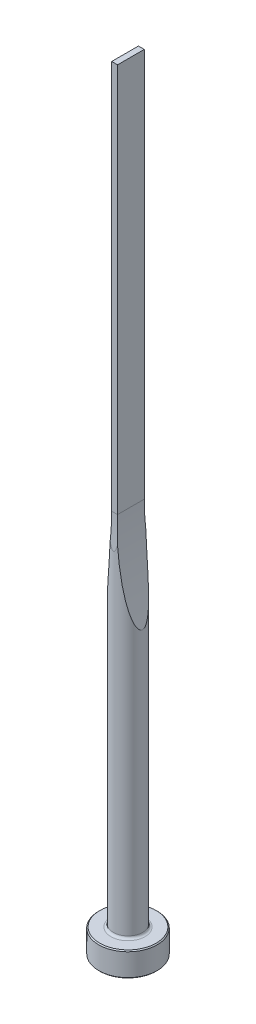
SolidWorks part; units mm, degrees
ref_plane "Front Plane" through (0, 0, 0) normal (0, 0, 1) x (1, 0, 0)
ref_plane "Top Plane" through (0, 0, 0) normal (0, 1, 0) x (1, 0, 0)
ref_plane "Right Plane" through (0, 0, 0) normal (1, 0, 0) x (0, 0, -1)
sketch "Sketch1" plane through (0, 0, 0) normal (0, 0, 1) x (1, 0, 0)
  line L0 (0, 0) -> (5.8, 0)
  line L1 (55, 0) -> (-55, 0) construction
  line L2 (6, 0.2) -> (6, 4.8)
  line L3 (5.8, 5) -> (3.5, 5)
  line L4 (3, 5.5) -> (3, 160)
  line L5 (0, 160) -> (3, 160)
  line L6 (6, 4.8) -> (5.8, 5)
  line L7 (5.8, 0) -> (6, 0.2)
  line L8 (0, 160) -> (0, 0)
  arc A0 (3, 5.5) -> (3.5, 5) centre (3.5, 5.5) ccw
  point P1 (6, 0)
  point P6 (6, 5)
  dimension "D4" = 0.5
  dimension "D1" = 3
  dimension "D2" = 6
  dimension "D3" = 5
  dimension "D5" = 160
revolve "Revolve1" add sketch "Sketch1" angle 360 about L8
sketch "Sketch2" plane through (0, 0, 0) normal (0, 0, 1) x (1, 0, 0)
  line L0 (0.6, 160) -> (0.6, 80)
  line L1 (3, 160) -> (-3, 160) construction
  line L2 (-0.6, 160) -> (-0.6, 80)
  line L3 (3, 160) -> (3, 59.3544)
  line L4 (-3, 160) -> (-3, 59.3544)
  line L5 (0, -6.6) -> (0, 6.6) construction
  line L6 (3, 160) -> (0.6, 160)
  line L8 (-0.6, 160) -> (-3, 160)
  arc A0 (0.6, 80) -> (3, 59.3544) centre (90.6, 80) ccw
  arc A1 (-0.6, 80) -> (-3, 59.3544) centre (-90.6, 80) cw
  dimension "D4" = 90
  dimension "D1" = 80
  dimension "D2" = 1.2
  dimension "D3" = 0.6
extrude "Cut-Extrude1" cut sketch "Sketch2" against normal mid plane 10
sketch "Sketch3" plane through (0, 0, 0) normal (1, 0, 0) x (0, 0, -1)
  line L0 (2.75, 160) -> (2.75, 80)
  line L1 (-2.9394, 160) -> (2.9394, 160) construction
  line L2 (-2.75, 160) -> (-2.75, 80)
  line L3 (3, 160) -> (3, 73.2965)
  line L4 (2.75, 160) -> (3, 160)
  line L5 (0, 6.6) -> (0, -6.6) construction
  line L6 (-3, 160) -> (-3, 73.2965)
  line L8 (-2.75, 160) -> (-3, 160)
  arc A0 (2.75, 80) -> (3, 73.2965) centre (92.75, 80) ccw
  arc A1 (-2.75, 80) -> (-3, 73.2965) centre (-92.75, 80) cw
  dimension "D2" = 90
  dimension "D1" = 80
  dimension "D3" = 5.5
  dimension "D4" = 2.75
extrude "Cut-Extrude2" cut sketch "Sketch3" against normal mid plane 10
